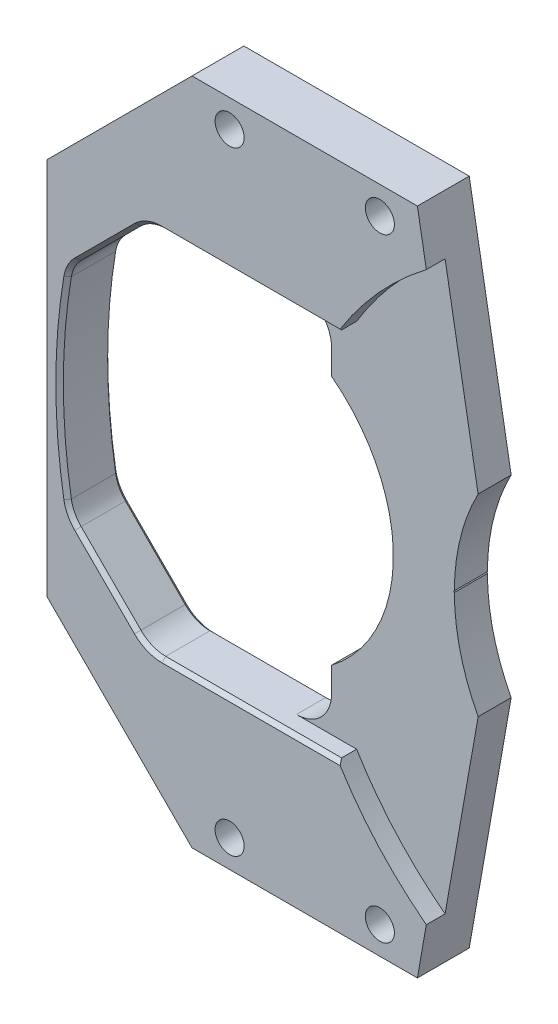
SolidWorks part; units mm, degrees
ref_plane "Front" through (0, 0, 0) normal (0, 0, 1) x (1, 0, 0)
ref_plane "Top" through (0, 0, 0) normal (0, 1, 0) x (1, 0, 0)
ref_plane "Right" through (0, 0, 0) normal (1, 0, 0) x (0, 0, -1)
sketch "Sketch1" plane through (0, 0, 0) normal (0, 0, 1) x (1, 0, 0)
  circle A0 centre (0, 0) radius 15.9766
  circle A1 centre (0, 0) radius 19.05
  dimension "D1" = 31.9532
  dimension "D2" = 38.1
extrude "Extrude1" add sketch "Sketch1" along normal blind 3.3528
sketch "Sketch2" plane through (0, 0, 0) normal (0, 0, 1) x (1, 0, 0)
  line L0 (-2.54, 33.909) -> (-16.533, 9.4638)
  line L1 (-2.54, 33.909) -> (19.05, 33.909)
  line L2 (19.05, 33.909) -> (19.05, 0)
  arc A0 (19.05, 0) -> (-16.533, 9.4638) centre (0, 0) ccw
  circle A2 centre (0, 0) radius 19.05 construction
  dimension "D1" = 33.909
  dimension "D2" = 2.54
extrude "Extrude2" add sketch "Sketch2" along normal up to surface (3.3528 mm away)
mirror "Mirror1" about plane through (0, 0, 0) normal (0, 1, 0) of "Extrude2"
sketch "Sketch5" plane through (0, 0, 3.3528) normal (0, 0, 1) x (1, 0, 0)
  line L0 (-2.54, -33.909) -> (19.05, -33.909)
  line L1 (-2.54, 33.909) -> (-16.533, 9.4638)
  line L2 (-2.54, -33.909) -> (-16.533, -9.4638)
  line L3 (-2.54, -33.909) -> (-16.533, -9.4638) construction
  line L4 (-2.54, 33.909) -> (-16.533, 9.4638) construction
  line L5 (-2.54, 33.909) -> (19.05, 33.909)
  line L6 (19.05, 33.909) -> (19.05, 26.9782)
  line L7 (19.05, -33.909) -> (19.05, 33.909) construction
  line L8 (19.05, -26.9782) -> (19.05, -33.909)
  arc A0 (9.3757, 12.9363) -> (9.3757, -12.9363) centre (0, 0) ccw
  arc A1 (-16.533, 9.4638) -> (-16.533, -9.4638) centre (0, 0) ccw
  arc A2 (-16.533, 9.4638) -> (-16.533, -9.4638) centre (0, 0) ccw construction
  circle A3 centre (0, 0) radius 15.9766 construction
  arc A4 (19.05, 26.9782) -> (9.3757, 12.9363) centre (43.18, 0) ccw
  arc A5 (9.3757, -12.9363) -> (19.05, -26.9782) centre (43.18, 0) ccw
  dimension "D2" = 72.39
  dimension "D1" = 43.18
extrude "Extrude3" add sketch "Sketch5" along normal blind 1.905
hole_wizard "#32 (0.116000) Diameter Hole1" positions "Sketch4" profile "Sketch3" hole size "#32" standard "Ansi Inch"
sketch "Sketch4" plane through (-7.9289, -24.2879, 5.2578) normal (0, 0, 1) x (1, 0, 0)
  arc A4 (17.3046, 37.2242) -> (17.3046, 11.3516) centre (7.9289, 24.2879) ccw construction
  point P0 (24.4389, -6.8271)
  point P1 (9.1989, -6.8271)
  point P2 (9.1989, 55.4029)
  point P3 (24.4389, 55.4029)
  dimension "D1" = 31.115
  dimension "D3" = 31.115
  dimension "D4" = 31.115
  dimension "D5" = 1.27
  dimension "D6" = 16.51
  dimension "D7" = 16.51
  dimension "D2" = 31.115
  dimension "D8" = 1.27
sketch "Sketch3" plane through (16.51, -31.115, 5.2578) normal (1, 0, 0) x (0, -1, 0)
  line L0 (0, 0) -> (0, 5.2578)
  line L1 (0, 5.2578) -> (1.4732, 5.2578)
  line L2 (1.4732, 5.2578) -> (1.4732, 0)
  line L5 (1.4732, 0) -> (0, 0)
  line L11 (0, -6.35) -> (0, 107.95) construction
  dimension "Thru Hole Dia." = 2.9464
  dimension "Thru Hole Depth" = 5.2578
sketch "Sketch6" plane through (0, 0, 0) normal (0, 0, -1) x (-1, 0, 0)
  line L0 (2.54, 33.909) -> (21.59, 14.859)
  line L1 (15.9766, 0) -> (21.59, 0)
  line L2 (21.59, 14.859) -> (21.59, 0)
  line L3 (-19.05, 33.909) -> (2.54, 33.909) construction
  line L4 (2.54, 33.909) -> (2.54, 15.7734)
  circle A0 centre (76.2, 0) radius 60.2234 construction
  circle A1 centre (0, 0) radius 15.9766 construction
  arc A2 (15.9766, 0) -> (2.54, 15.7734) centre (0, 0) ccw
  arc A3 (-9.3757, 12.9363) -> (-19.05, 26.9782) centre (-43.18, 0) ccw construction
  point P2 (-43.18, 0)
  dimension "D1" = 43.18
  dimension "D2" = 76.2
  dimension "D3" = 21.59
  dimension "D4" = 225
extrude "Extrude4" add sketch "Sketch6" against normal up to surface (5.2578 mm away)
mirror "Mirror2" about plane through (0, 0, 0) normal (0, 1, 0) of "Extrude4"
sketch "Sketch7" plane through (0, 0, 0) normal (0, 0, -1) x (-1, 0, 0)
  line L1 (0, 0) -> (-34.5373, 0) construction
  line L2 (-9.7028, 18.796) -> (7.0671, 18.796)
  line L3 (7.0671, 18.796) -> (14.9639, 10.8993)
  line L4 (-9.7028, 18.796) -> (-9.7028, 0)
  line L5 (-9.7028, 0) -> (15.9766, 0)
  line L6 (2.54, 33.909) -> (21.59, 14.859) construction
  arc A0 (15.9766, 0) -> (14.9639, 10.8993) centre (-43.18, 0) ccw
  circle A2 centre (0, 0) radius 15.9766 construction
  circle A3 centre (76.2, 0) radius 60.2234 construction
  dimension "D3" = 18.796
  dimension "D2" = 9.7028
  dimension "D4" = 18.288
extrude "Cut-Extrude1" cut sketch "Sketch7" against normal through all
fillet "Fillet1" radius 3.556 3 edges at (-7.0671, 18.796, 2.6289) (9.7028, 18.796, 2.6289) (-14.9639, 10.8993, 2.6289)
mirror "Mirror3" about plane through (0, 0, 0) normal (0, 1, 0) of "Fillet1", "Cut-Extrude1"
chamfer "Chamfer3" distance 4.318 angle 45 1 edges at (-21.59, 0, 5.2578)
sketch "Sketch8" plane through (0, 0, 3.3528) normal (0, 0, 1) x (1, 0, 0)
  line L1 (3.9335, 18.796) -> (23.6679, 18.796)
  line L2 (3.9335, 18.796) -> (3.9335, 5.3576)
  line L3 (3.9335, 5.3576) -> (23.6679, 5.3576)
  line L4 (23.6679, 18.796) -> (23.6679, 5.3576)
  line L5 (6.1468, 18.796) -> (-5.5942, 18.796) construction
extrude "Cut-Extrude4" cut sketch "Sketch8" along normal through all
mirror "Mirror4" about plane through (0, 0, 0) normal (0, 1, 0) of "Cut-Extrude4"
chamfer "Chamfer4" distance 0.381 angle 45 9 edges at (3.3269, -18.796, 5.2578) (-6.955, -18.5253, 5.2578) (-11.1407, -14.7225, 5.2578) (-11.1407, 14.7225, 5.2578) (-6.955, 18.5253, 5.2578) (3.3269, 18.796, 5.2578) (-14.8196, -10.8042, 5.2578) (-15.9766, 0, 5.2578) (-14.8196, 10.8042, 5.2578)
chamfer "Chamfer2" distance 0.381 angle 45 14 edges at (15.9766, 0, 0) (9.7028, 13.9664, 0) (8.6613, 17.7545, 0) (0.2763, 18.796, 0) (-6.955, 18.5253, 0) (-11.1407, 14.7225, 0) (-11.1407, -14.7225, 0) (-6.955, -18.5253, 0) (0.2763, -18.796, 0) (8.6613, -17.7545, 0) (9.7028, -13.9664, 0) (-14.8196, 10.8042, 0) (-15.9766, 0, 0) (-14.8196, -10.8042, 0)
sketch "Sketch9" plane through (0, 0, 0) normal (0, 0, -1) x (-1, 0, 0)
  line L0 (-19.05, 33.909) -> (-19.05, 0)
  line L1 (-20.32, 33.909) -> (-24.5748, 9.7788)
  line L6 (-19.05, -33.909) -> (-19.05, 33.909) construction
  line L7 (-19.05, 0) -> (-22.1615, 0)
  line L9 (-20.32, 33.909) -> (-19.05, 33.909)
  arc A0 (-22.1615, 0) -> (-24.5748, 9.7788) centre (-43.18, 0) ccw
  dimension "D1" = 42.037
  dimension "D2" = 1.27
  dimension "D3" = 10
  dimension "D4" = 9.7788
extrude "Extrude5" add sketch "Sketch9" against normal up to surface (5.2578 mm away)
mirror "Mirror5" about plane through (0, 0, 0) normal (0, 1, 0) of "Extrude5"
sketch "Sketch10" plane through (0, 0, 3.3528) normal (0, 0, 1) x (1, 0, 0)
  circle A0 centre (43.18, 0) radius 36.195
  arc A1 (12.4828, -19.177) -> (19.05, -26.9782) centre (43.18, 0) ccw construction
extrude "Cut-Extrude5" cut sketch "Sketch10" along normal through all
sketch "Sketch11" plane through (0, 0, 3.3528) normal (0, 0, 1) x (1, 0, 0)
  line L0 (22.0853, 0) -> (30.2058, 8.1205)
  line L1 (22.0853, 0) -> (30.2058, -8.1205)
  line L2 (30.2058, 8.1205) -> (30.2058, -8.1205)
  arc A0 (24.5748, 9.7788) -> (24.5748, -9.7788) centre (43.18, 0) ccw construction
  dimension "D1" = 0.0762
extrude "Cut-Extrude6" cut sketch "Sketch11" against normal through all
